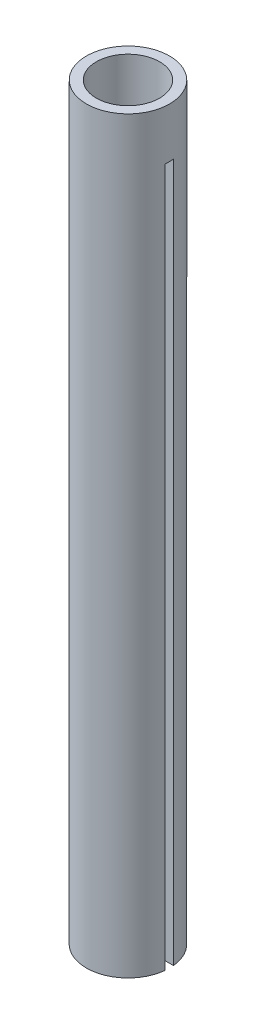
SolidWorks part; units mm, degrees
ref_plane "Front Plane" through (0, 0, 0) normal (0, 0, 1) x (1, 0, 0)
ref_plane "Top Plane" through (0, 0, 0) normal (0, 1, 0) x (1, 0, 0)
ref_plane "Right Plane" through (0, 0, 0) normal (1, 0, 0) x (0, 0, -1)
sketch "Esquisse1" plane through (0, 0, 0) normal (0, 1, 0) x (1, 0, 0)
  circle A0 centre (0, 0) radius 12.5
  circle A1 centre (0, 0) radius 9.5
  dimension "D1" = 25
  dimension "D2" = 3
extrude "Boss.-Extru.1" add sketch "Esquisse1" against normal blind 225
sketch "Esquisse2" plane through (0, 0, 0) normal (1, 0, 0) x (0, 0, -1)
  line L1 (-1.25, -15) -> (1.25, -15)
  line L2 (-1.25, -15) -> (-1.25, -225)
  line L3 (-1.25, -225) -> (1.25, -225)
  line L4 (1.25, -15) -> (1.25, -225)
  line L5 (9.5, 0) -> (-9.5, 0) construction
  line L6 (-12.5, -225) -> (12.5, -225) construction
  point P4 (0, -15)
  dimension "D1" = 2.5
  dimension "D2" = 15
extrude "Enlèv. mat.-Extru.1" cut sketch "Esquisse2" along normal through all
